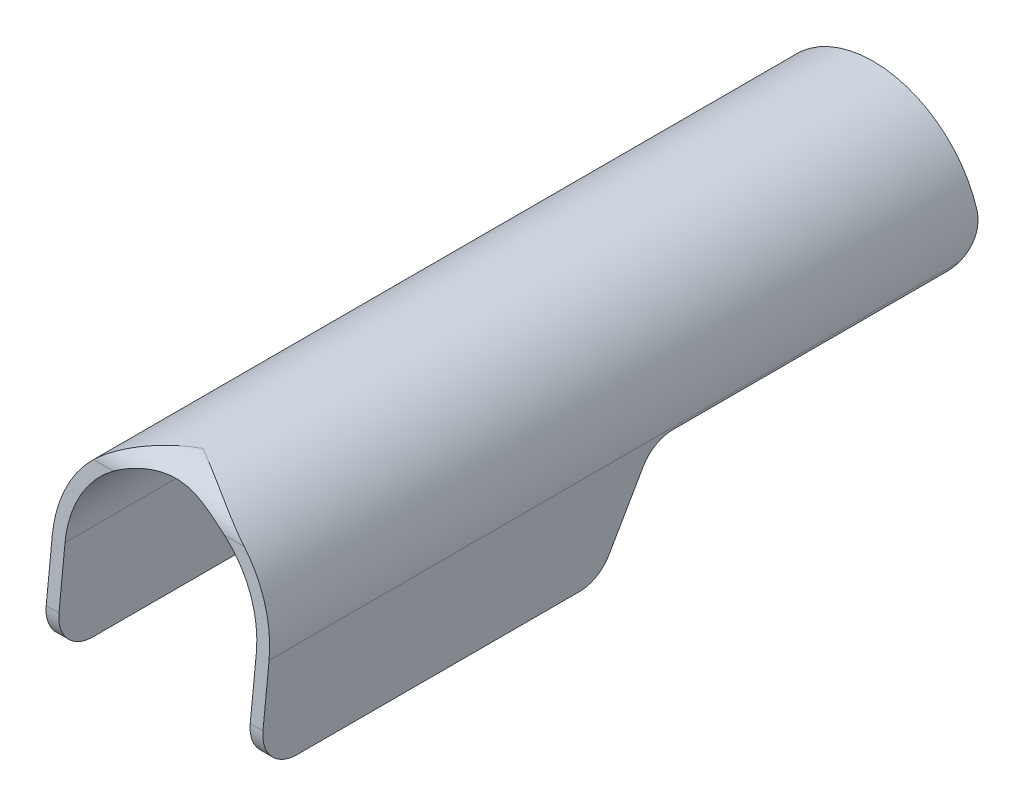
SolidWorks part; units mm, degrees
ref_plane "Plan de face" through (0, 0, 0) normal (0, 0, 1) x (1, 0, 0)
ref_plane "Plan de dessus" through (0, 0, 0) normal (0, 1, 0) x (1, 0, 0)
ref_plane "Plan de droite" through (0, 0, 0) normal (1, 0, 0) x (0, 0, -1)
sketch "Esquisse1" plane through (0, 0, 0) normal (0, 0, 1) x (1, 0, 0)
  line L0 (-48.9041, -22.5) -> (38.9096, -22.5) construction
  line L1 (-22.5, 0) -> (-22.5, -22.5)
  line L2 (22.5, 0) -> (22.5, -22.5)
  arc A0 (22.5, 0) -> (-22.5, 0) centre (0, 0) ccw
  dimension "D1" = 45
  dimension "D2" = 22.5
extrude "Extru.-Mince1" add sketch "Esquisse1" along normal blind 170 thin
sketch "Esquisse2" plane through (0, 0, 0) normal (1, 0, 0) x (0, 0, -1)
  line L0 (-165.7079, 18.3362) -> (-169.0713, -13.6638)
  line L1 (0, 25.5) -> (-170, 25.5) construction
  line L2 (-161.1151, -22.5) -> (-94.6188, -22.5)
  line L3 (-170, -22.5) -> (0, -22.5) construction
  line L4 (-87.6906, -18.5) -> (-79.6077, -4.5)
  line L5 (-72.6795, -0.5) -> (-8, -0.5)
  line L6 (0, -22.5) -> (0, 0) construction
  line L7 (0, 7.5) -> (0, 25.5)
  line L8 (0, 25.5) -> (-157.7518, 25.5)
  line L9 (-170, -22.5) -> (-170, 0) construction
  line L10 (-170, 22.5) -> (-170, 0) construction
  arc A0 (-169.0713, -13.6638) -> (-161.1151, -22.5) centre (-161.1151, -14.5) ccw
  arc A1 (-165.7079, 18.3362) -> (-157.7518, 25.5) centre (-157.7518, 17.5) cw
  arc A2 (-79.6077, -4.5) -> (-72.6795, -0.5) centre (-72.6795, -8.5) cw
  arc A3 (-8, -0.5) -> (0, 7.5) centre (-8, 7.5) ccw
  arc A4 (-94.6188, -22.5) -> (-87.6906, -18.5) centre (-94.6188, -14.5) ccw
  point P16 (-170, -22.5)
  point P19 (-164.955, 25.5)
  point P24 (0, -0.5)
  point P29 (-90, -22.5)
  dimension "D1" = 8
  dimension "D5" = 8
  dimension "D2" = 80
  dimension "D3" = 22
  dimension "D4" = 30
  dimension "D6" = 6
extrude "Enlèv. mat.-Extru.1" cut sketch "Esquisse2" against normal through all and the other way through all flip side to cut
ref_plane "Plan2" through (0, 64.86, 0) normal (0, -1, 0) x (1, 0, 0)
